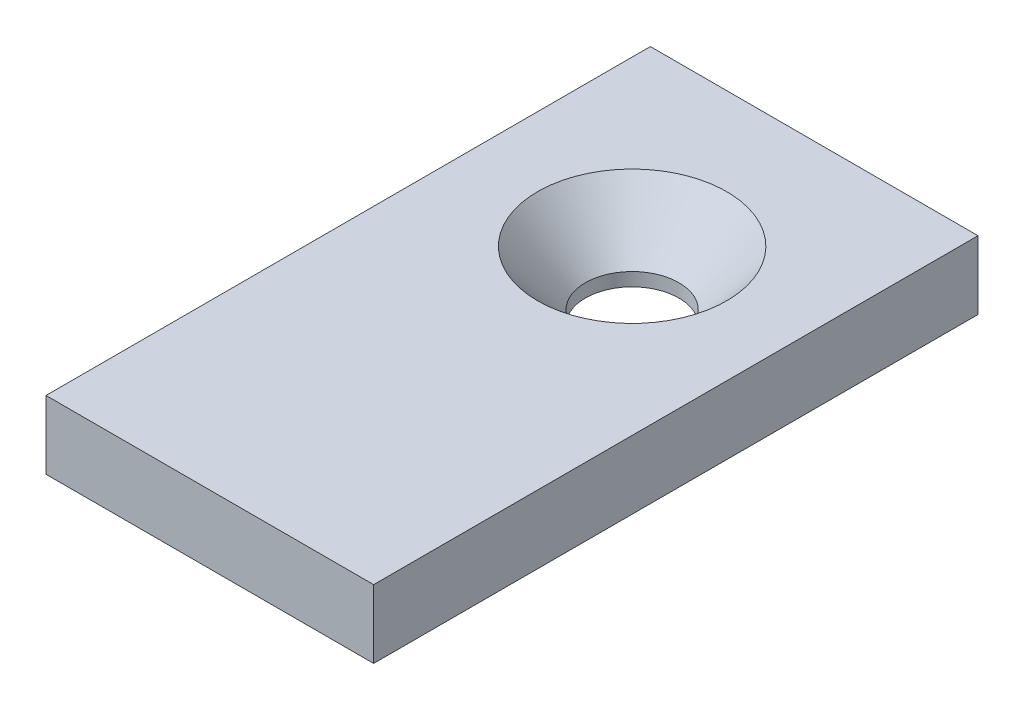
SolidWorks part; units mm, degrees
ref_plane "Front" through (0, 0, 0) normal (0, 0, 1) x (1, 0, 0)
ref_plane "Top" through (0, 0, 0) normal (0, 1, 0) x (1, 0, 0)
ref_plane "Right" through (0, 0, 0) normal (1, 0, 0) x (0, 0, -1)
sketch "Sketch1" plane through (0, 0, 0) normal (0, 0, 1) x (1, 0, 0)
  line L1 (0, 1.1906) -> (11.43, 1.1906)
  line L2 (0, 1.1906) -> (0, -1.1906)
  line L3 (0, -1.1906) -> (11.43, -1.1906)
  line L4 (11.43, 1.1906) -> (11.43, -1.1906)
  dimension "D1" = 2.3813
  dimension "D2" = 11.43
extrude "Extrude1" add sketch "Sketch1" along normal blind 21.082
hole_wizard "CSK for #4 Flat Head Machine Screw (100)1" positions "Sketch3" profile "Sketch2" countersink size "#4" standard "Ansi Inch"
sketch "Sketch3" plane through (0, 1.1906, 0) normal (0, 1, 0) x (-1, 0, 0)
  line L0 (-11.43, 0) -> (0, 0) construction
  line L1 (-11.43, 6.35) -> (0, 6.35) construction
  line L2 (-11.43, 21.082) -> (-11.43, 0) construction
  line L3 (0, 21.082) -> (0, 0) construction
  point P0 (-5.715, 6.35)
  point P9 (-5.715, 6.35)
  dimension "D1" = 6.35
sketch "Sketch2" plane through (5.715, 1.1906, 6.35) normal (1, 0, 0) x (0, 0, 1)
  line L0 (0, 0) -> (0, 2.3813)
  line L1 (0, 2.3813) -> (1.6319, 2.3813)
  line L2 (1.6319, 2.3813) -> (1.632, 1.9178)
  line L3 (1.632, 1.9178) -> (3.2991, 0)
  line L5 (3.2991, 0) -> (0, 0)
  line L6 (-1.632, 1.9178) -> (-3.2991, 0) construction
  line L11 (0, -6.35) -> (0, 107.95) construction
  dimension "Thru Hole Dia." = 3.2639
  dimension "Thru Hole Depth" = 2.3813
  dimension "Near C'Sink Dia." = 6.5982
  dimension "Near C'Sink Angle" = 82
